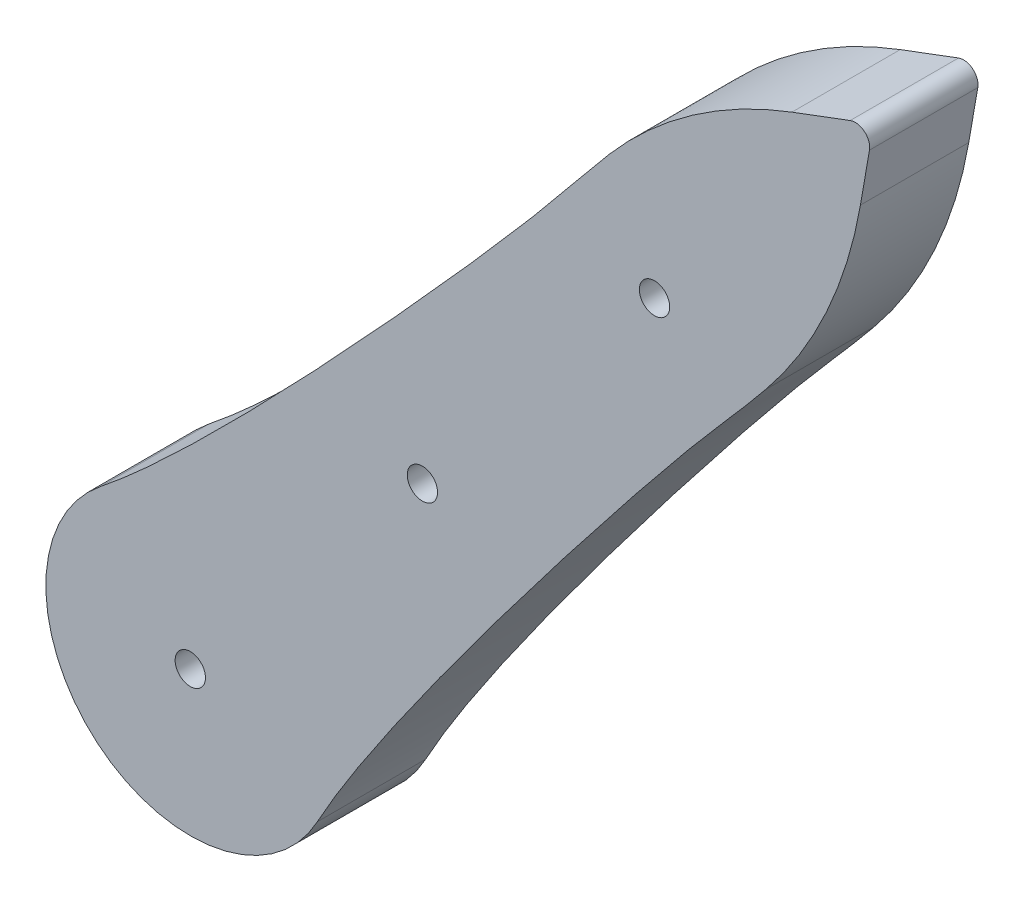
SolidWorks part; units mm, degrees
ref_plane "Front Plane" through (0, 0, 0) normal (0, 0, 1) x (1, 0, 0)
ref_plane "Top Plane" through (0, 0, 0) normal (0, 1, 0) x (1, 0, 0)
ref_plane "Right Plane" through (0, 0, 0) normal (1, 0, 0) x (0, 0, -1)
sketch "Sketch3" plane through (0, 0, 16) normal (0, 0, 1) x (1, 0, 0)
  line L0 (141.7182, -118.9157) -> (13.1607, -272.1246) construction
  line L2 (135.2182, -125.4157) -> (148.2182, -125.4157) construction
  line L3 (135.2182, -125.4157) -> (135.2182, -112.4157) construction
  line L4 (135.2182, -112.4157) -> (148.2182, -112.4157) construction
  line L5 (148.2182, -125.4157) -> (148.2182, -112.4157) construction
  line L6 (135.2182, -125.4157) -> (148.2182, -112.4157) construction
  line L7 (135.2182, -112.4157) -> (148.2182, -125.4157) construction
  arc A0 (155.0191, -142.9851) -> (115.7048, -109.9965) centre (141.7182, -118.9157) ccw
  circle A1 centre (109.5788, -157.2179) radius 1.6 construction
  circle A2 centre (135.2182, -112.4157) radius 1.6
  arc A3 (0.7245, -256.4612) -> (30.7456, -281.652) centre (13.1607, -272.1246) ccw
  circle A4 centre (148.2182, -112.4157) radius 1.6
  circle A5 centre (148.2182, -125.4157) radius 1.6
  circle A6 centre (135.2182, -125.4157) radius 1.6
  circle A7 centre (77.4395, -195.5202) radius 1.6
  circle A8 centre (45.3001, -233.8224) radius 1.6
  circle A9 centre (13.1607, -272.1246) radius 1.6
  spline S0 degree 3 poles (115.7048, -109.9965) (101.9488, -150.1167) (78.1788, -171.7728) (58.7171, -197.0824) (16.357, -244.0495) (0.7245, -256.4612) knots 0 0 0 0 0.61909 0.71909 1 1 1 1
  spline S1 degree 3 poles (155.0191, -142.9851) (117.8971, -163.4989) (100.6976, -190.6684) (79.1521, -214.2294) (40.2542, -264.1017) (30.7456, -281.652) knots 0 0 0 0 0.61909 0.71909 1 1 1 1
extrude "Boss-Extrude1" add sketch "Sketch3" along normal blind 15
sketch "Sketch4" plane through (0, 0, 31) normal (0, 0, 1) x (1, 0, 0)
  line L1 (81.6816, -169.2386) -> (116.9009, -107.0687)
  line L5 (103.1733, -186.0751) -> (159.1617, -140.1754)
  line L6 (81.6816, -169.2386) -> (107.8011, -159.4411)
  line L7 (103.1733, -186.0751) -> (107.8011, -159.4411)
  arc A0 (159.1442, -140.1897) -> (116.9009, -107.0687) centre (141.7182, -118.9157) ccw
  arc A1 (159.1442, -140.1897) -> (116.9009, -107.0687) centre (141.7182, -118.9157) ccw
  spline S0 degree 3 poles (115.7048, -109.9965) (101.9488, -150.1167) (78.1788, -171.7728) (58.7171, -197.0824) (16.357, -244.0495) (0.7245, -256.4612) knots 0 0 0 0 0.61909 0.71909 1 1 1 1 construction
  spline S1 degree 3 poles (30.7456, -281.652) (40.2542, -264.1017) (79.1521, -214.2294) (100.6976, -190.6684) (117.8971, -163.4989) (155.0191, -142.9851) knots 0 0 0 0 0.28091 0.38091 1 1 1 1 construction
  dimension "D1" = 55
extrude "Cut-Extrude1" cut sketch "Sketch4" against normal blind 15
fillet "Fillet3" radius 62 2 edges at (81.6816, -169.2386, 23.5) (103.1733, -186.0751, 23.5)
sketch "Sketch5" plane through (0, 0, 31) normal (0, 0, 1) x (1, 0, 0)
  circle A1 centre (77.4395, -195.5202) radius 2.1
  circle A2 centre (45.3001, -233.8224) radius 2.1
  circle A3 centre (13.1607, -272.1246) radius 2.1
extrude "Cut-Extrude2" cut sketch "Sketch5" against normal blind 15
fillet "Fillet4" radius 2 1 edges at (107.8011, -159.4411, 23.5)
equation "\"thighLength\"=185"
equation "\"legLength\"=200"
equation "\"m3Thru\"=3.2"
equation "\"m4Thru\"=4.3"
equation "\"m3Insert\"=4.2"
equation "\"m4Insert\"=5.3"
equation "\"shoulder5mm\"=5.1"
equation "\"6706out\"=37.125"
equation "\"6706in\"=30"
equation "\"6904out\"=30.125"
equation "\"6904in\"=17"
equation "\"D1@Sketch5\"=\"m3Insert\" "
equation "\"D2@Sketch5\"=\"m3Insert\" "
equation "\"D3@Sketch5\"=\"m3Insert\" "
